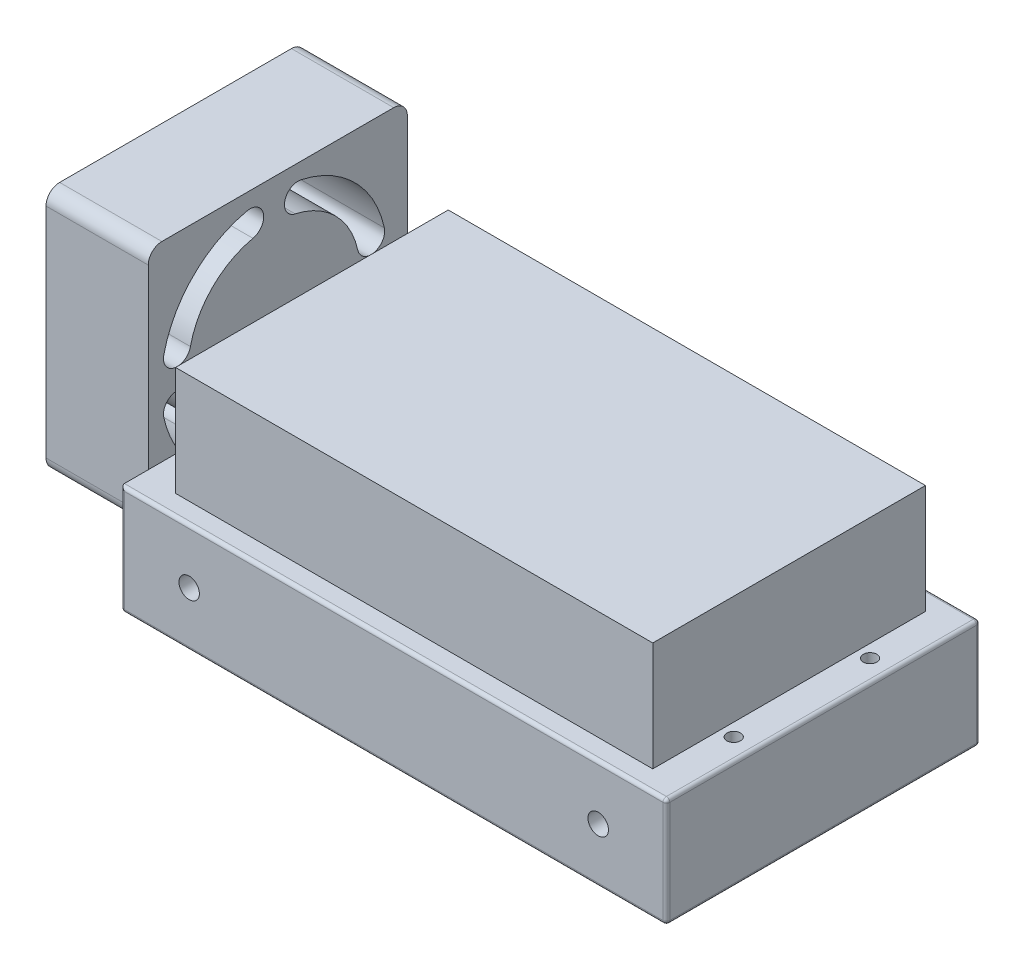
SolidWorks part; units mm, degrees
ref_plane "Front Plane" through (0, 0, 0) normal (0, 0, 1) x (1, 0, 0)
ref_plane "Top Plane" through (0, 0, 0) normal (0, 1, 0) x (1, 0, 0)
ref_plane "Right Plane" through (0, 0, 0) normal (1, 0, 0) x (0, 0, -1)
sketch "Sketch1" plane through (0, 0, 0) normal (0, 1, 0) x (1, 0, 0)
  line L1 (-40, -23) -> (40, -23)
  line L2 (-40, -23) -> (-40, 23)
  line L3 (-40, 23) -> (40, 23)
  line L4 (40, -23) -> (40, 23)
  line L5 (-40, -23) -> (40, 23) construction
  line L6 (-40, 23) -> (40, -23) construction
  point P0 (0, 0)
  dimension "D1" = 46
  dimension "D2" = 80
extrude "Boss-Extrude1" add sketch "Sketch1" along normal blind 16
sketch "Sketch2" plane through (-40, 0, 0) normal (-1, 0, 0) x (0, 0, 1)
  line L0 (-23, 0) -> (23, 0) construction
  line L1 (-19, 8) -> (19, 8)
  line L2 (-19, 8) -> (-19, 44)
  line L3 (-19, 44) -> (19, 44)
  line L4 (19, 8) -> (19, 44)
  point P4 (4.2852, 23.8786)
  point P5 (0, 8)
  point P9 (-18.8713, 12.2962)
  dimension "D1" = 44
  dimension "D2" = 38
  dimension "D3" = 36
extrude "Boss-Extrude2" add sketch "Sketch2" along normal blind 15
sketch "Sketch3" plane through (-55, 0, 0) normal (-1, 0, 0) x (0, 0, 1)
  line L0 (19, 8) -> (19, 44) construction
  line L1 (0, 26) -> (-14, 26) construction
  line L2 (0, 26) -> (0, 40) construction
  circle A0 centre (0, 26) radius 14 construction
  arc A1 (-13.6786, 28.9827) -> (-2.9827, 39.6786) centre (0, 26) cw construction
  arc A2 (-3.4088, 41.6327) -> (-15.6327, 29.4088) centre (0, 26) ccw
  arc A3 (-2.5566, 37.7245) -> (-11.7245, 28.5566) centre (0, 26) ccw
  arc A4 (-2.5566, 37.7245) -> (-3.4088, 41.6327) centre (-2.9827, 39.6786) ccw
  arc A5 (-15.6327, 29.4088) -> (-11.7245, 28.5566) centre (-13.6786, 28.9827) ccw
  point P4 (19, 26)
  point P6 (-9.8995, 35.8995)
  point P14 (0, 0)
  dimension "D1" = 28
  dimension "D4" = 2
  dimension "D2" = 3
  dimension "D3" = 3
extrude "Cut-Extrude1" cut sketch "Sketch3" against normal up to surface (15 mm away)
pattern_circular "CirPattern1" count 4 over 360 about axis through (0, 25.4552, 0.5448) along (1, 0, 0) of "Cut-Extrude1"
fillet "Fillet1" radius 2 4 edges at (-47.5, 8, -19) (-47.5, 8, 19) (-47.5, 44, -19) (-47.5, 44, 19)
fillet "Fillet2" radius 0.5 11 edges at (-40, 0, 0) (0, 16, -23) (-40, 8, -23) (0, 0, -23) (40, 16, 0) (40, 8, -23) (40, 0, 0) (-40, 8, 23) (0, 16, 23) (40, 8, 23) (0, 0, 23)
sketch "Sketch4" plane through (0, 16, 0) normal (0, 1, 0) x (1, 0, 0)
  line L1 (35, -20) -> (-35, -20)
  line L2 (35, -20) -> (35, 20)
  line L3 (35, 20) -> (-35, 20)
  line L4 (-35, -20) -> (-35, 20)
  line L5 (35, -20) -> (-35, 20) construction
  line L6 (35, 20) -> (-35, -20) construction
  point P0 (0, 0)
  dimension "D1" = 40
  dimension "D2" = 70
extrude "Boss-Extrude3" add sketch "Sketch4" along normal blind 16
sketch "Sketch5" plane through (0, 0, 23) normal (0, 0, 1) x (1, 0, 0)
  line L0 (-30, 8) -> (30, 8) construction
  line L1 (39.5, 0) -> (-39.5, 0) construction
  line L3 (-28.0907, 8) -> (27.5011, 8) construction
  circle A2 centre (-30, 8) radius 1.5
  circle A3 centre (30, 8) radius 1.5
  point P1 (0, 8)
  dimension "D3" = 3
  dimension "D1" = 60
  dimension "D2" = 8
extrude "Cut-Extrude2" cut sketch "Sketch5" against normal blind 6
sketch "Sketch6" plane through (0, 16, 0) normal (0, 1, 0) x (1, 0, 0)
  line L0 (36.8737, -10) -> (36.8737, 10) construction
  circle A0 centre (36.8737, 10) radius 1
  circle A1 centre (36.8737, -10) radius 1
  point P2 (36.8737, 0)
  dimension "D2" = 2
  dimension "D1" = 20
extrude "Cut-Extrude3" cut sketch "Sketch6" against normal through all
